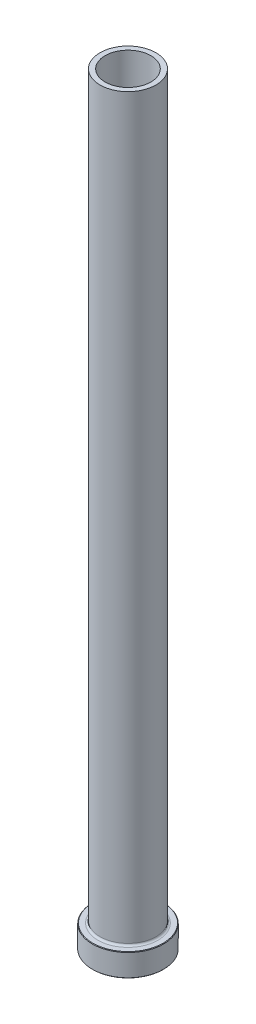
SolidWorks part; units mm, degrees
ref_plane "Front Plane" through (0, 0, 0) normal (0, 0, 1) x (1, 0, 0)
ref_plane "Top Plane" through (0, 0, 0) normal (0, 1, 0) x (1, 0, 0)
ref_plane "Right Plane" through (0, 0, 0) normal (1, 0, 0) x (0, 0, -1)
sketch "Sketch1" plane through (0, 0, 0) normal (0, 0, 1) x (1, 0, 0)
  line L0 (-9, 300) -> (-11, 300)
  line L1 (-11, 300) -> (-11, 9)
  line L2 (-11, 9) -> (-14, 9)
  line L3 (-14, 9) -> (-14, 0)
  line L4 (15.4, 0) -> (-15.4, 0) construction
  line L5 (-14, 0) -> (-9.25, 0)
  line L6 (-9, 245) -> (-9, 300)
  line L7 (0, 92.1877) -> (0, -15.5353) construction
  line L8 (0, -15.4) -> (0, 15.4) construction
  line L9 (-9, 245) -> (-9.25, 233)
  line L10 (-9.25, 233) -> (-9.25, 0)
  dimension "D1" = 0.25
  dimension "ID" = 18
  dimension "OD" = 22
  dimension "L" = 300
  dimension "H" = 28
  dimension "T" = 9
  dimension "N" = 55
  dimension "D2" = 12
revolve "Revolve1" add sketch "Sketch1" angle 360 about L7
fillet "Fillet1" radius 0.8 1 edges at (0, 9, 11)
chamfer "Chamfer1" distance 0.2 angle 45 2 edges at (0, 9, 14) (0, 0, 14)
chamfer "Chamfer3" distance 0.5 angle 45 1 edges at (0, 0, 9.25)
